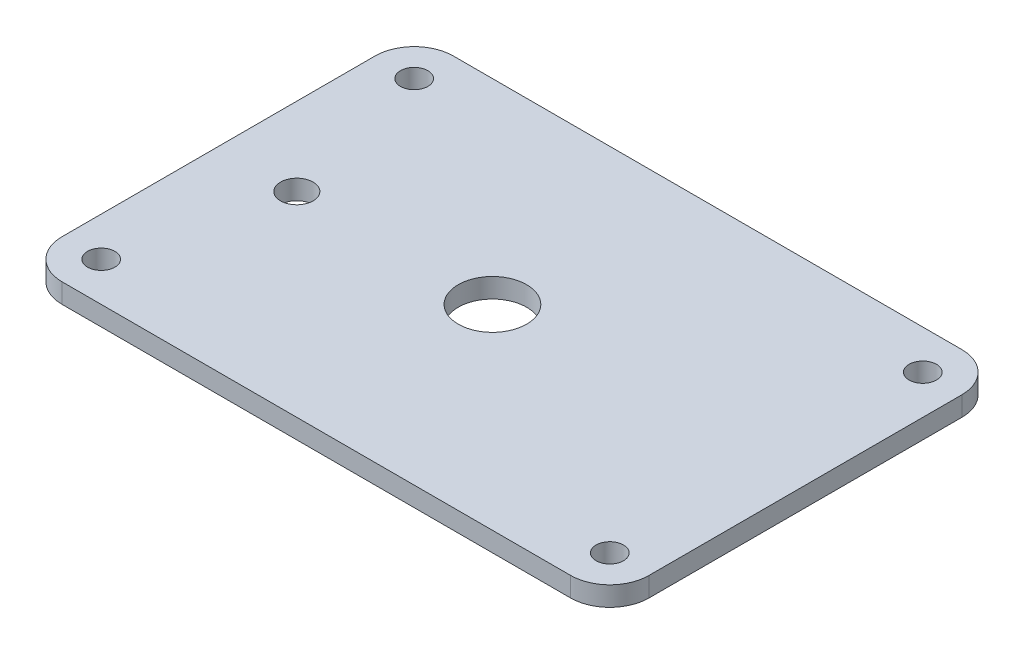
SolidWorks part; units mm, degrees
ref_plane "Front" through (0, 0, 0) normal (0, 0, 1) x (1, 0, 0)
ref_plane "Top" through (0, 0, 0) normal (0, 1, 0) x (1, 0, 0)
ref_plane "Right" through (0, 0, 0) normal (1, 0, 0) x (0, 0, -1)
sketch "Sketch1" plane through (0, 0, 0) normal (0, 1, 0) x (1, 0, 0)
  line L0 (90, 30) -> (0, 30) construction
  line L1 (6, 0) -> (84, 0)
  line L2 (0, 6) -> (0, 54)
  line L3 (6, 60) -> (84, 60)
  line L4 (90, 6) -> (90, 54)
  circle A0 centre (42, 30) radius 5.25
  circle A1 centre (12, 30) radius 2.5
  arc A6 (0, 54) -> (6, 60) centre (6, 54) cw
  arc A7 (6, 0) -> (0, 6) centre (6, 6) cw
  arc A8 (84, 0) -> (90, 6) centre (84, 6) ccw
  arc A9 (90, 54) -> (84, 60) centre (84, 54) ccw
  point P21 (0, 0)
  dimension "D1" = 6
  dimension "D2" = 10.5
  dimension "D3" = 5
  dimension "D6" = 42
  dimension "D7" = 12
  dimension "D4" = 90
  dimension "D5" = 60
extrude "Extrude1" add sketch "Sketch1" along normal blind 3
sketch "Sketch2" plane through (0, 3, 0) normal (0, 1, 0) x (1, 0, 0)
  point P0 (84, 54)
  point P1 (84, 6)
  point P3 (6, 6)
  point P5 (6, 54)
hole_wizard "M5 Tapped Hole1" positions "3DSketch1" profile "Sketch3" tap size "M5" standard "ISO"
sketch3d "3DSketch1"
  point P0 (6, 3, -54)
  point P3 (6, 3, -6)
  point P6 (84, 3, -6)
  point P9 (84, 3, -54)
sketch "Sketch3" plane through (6, 3, -54) normal (1, 0, 0) x (0, 0, 1)
  line L0 (0, 0) -> (0, 3)
  line L1 (0, 3) -> (2.1, 3)
  line L2 (2.1, 3) -> (2.1, 0)
  line L5 (2.1, 0) -> (0, 0)
  line L11 (0, -6.35) -> (0, 107.95) construction
  dimension "Thru Tap Drill Dia." = 4.2
  dimension "Thru Tap Drill Depth" = 3
